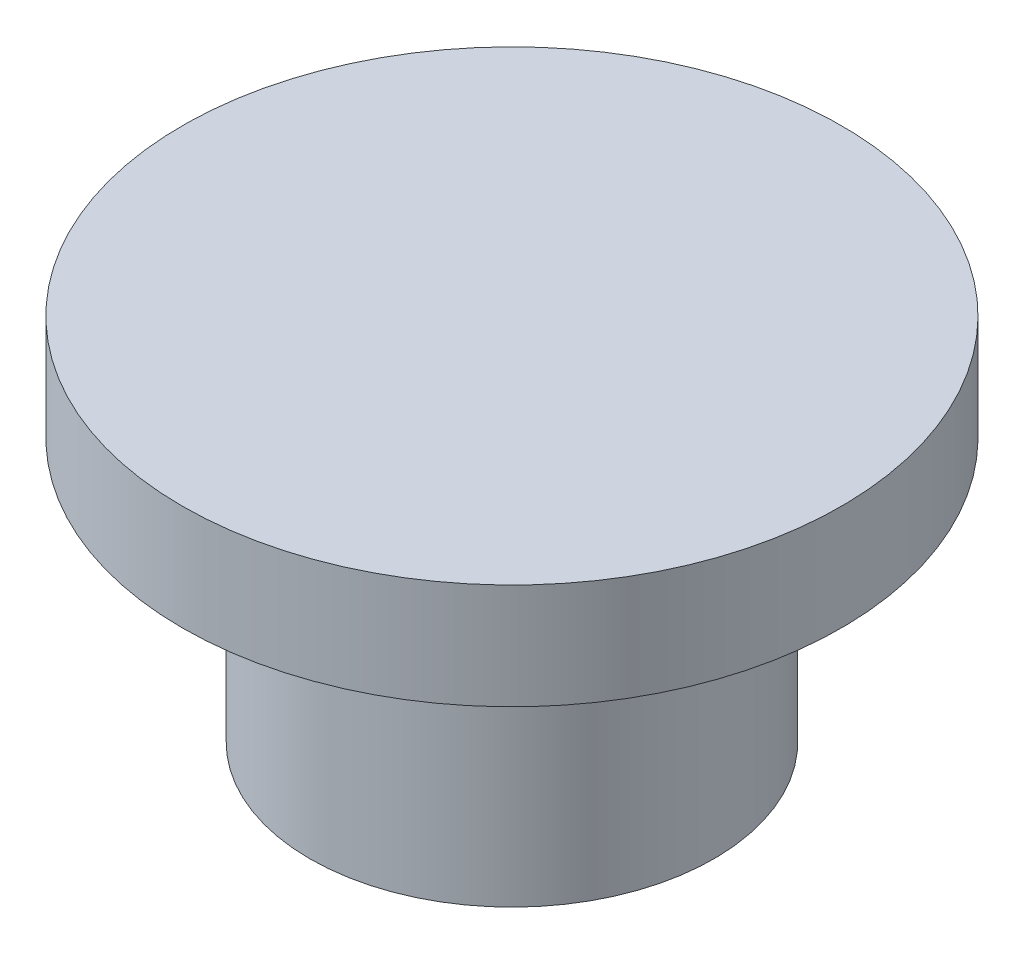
SolidWorks part; units mm, degrees
ref_plane "Plan de face" through (0, 0, 0) normal (0, 0, 1) x (1, 0, 0)
ref_plane "Plan de dessus" through (0, 0, 0) normal (0, 1, 0) x (1, 0, 0)
ref_plane "Plan de droite" through (0, 0, 0) normal (1, 0, 0) x (0, 0, -1)
sketch "Esquisse1" plane through (0, 0, 0) normal (0, 1, 0) x (1, 0, 0)
  circle A0 centre (0, 0) radius 7.665
  dimension "D1" = 15.33
extrude "Extrusion1" add sketch "Esquisse1" along normal blind 10
sketch "Esquisse2" plane through (0, 10, 0) normal (0, 1, 0) x (1, 0, 0)
  circle A0 centre (0, 0) radius 12.5
  dimension "D1" = 25
extrude "Extrusion2" add sketch "Esquisse2" along normal blind 4
